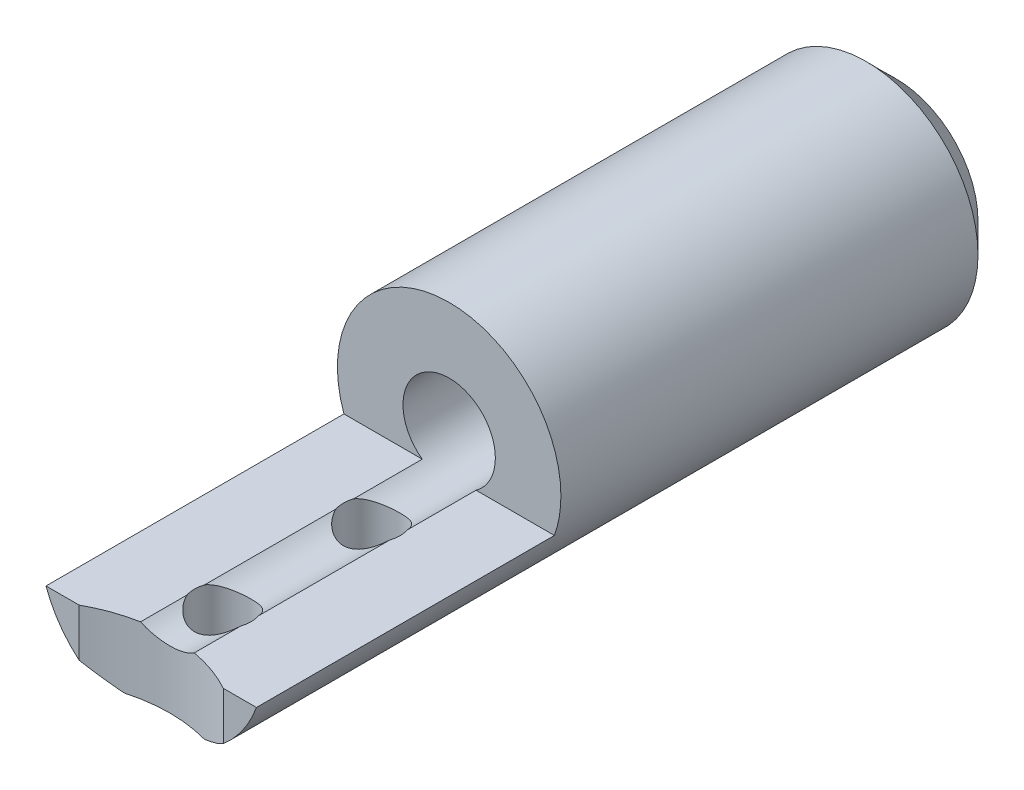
SolidWorks part; units mm, degrees
ref_plane "Front" through (0, 0, 0) normal (0, 0, 1) x (1, 0, 0)
ref_plane "Top" through (0, 0, 0) normal (0, 1, 0) x (1, 0, 0)
ref_plane "Right" through (0, 0, 0) normal (1, 0, 0) x (0, 0, -1)
sketch "Sketch1" plane through (0, 0, 0) normal (0, 0, 1) x (1, 0, 0)
  circle A0 centre (0, 0) radius 3.937
  circle A1 centre (0, 0) radius 9.525
extrude "Extrude1" add sketch "Sketch1" against normal blind 63.5
sketch "Sketch2" plane through (0, 0, 0) normal (0, 0, 1) x (1, 0, 0)
  line L0 (0, 3.2004) -> (0, -5.0881) construction
  line L1 (-9.525, -3.2004) -> (9.525, -3.2004)
  line L3 (9.525, 3.2004) -> (9.525, -3.2004)
  line L4 (-9.525, 3.2004) -> (-9.525, -3.2004)
  arc A1 (9.525, 3.2004) -> (-9.525, 3.2004) centre (0, 0.4024) ccw
  point P3 (0, -3.2004)
extrude "Cut-Extrude1" cut sketch "Sketch2" against normal blind 25.4
sketch "Sketch3" plane through (0, 0, 0) normal (0, 0, 1) x (1, 0, 0)
  line L0 (0, -3.937) -> (0, -9.525)
  line L1 (0, -9.525) -> (6.5942, -9.525)
  line L2 (6.5942, -9.525) -> (6.5942, -8.89)
  line L3 (6.5942, -8.89) -> (-6.1872, -8.89)
  line L4 (-6.1872, -8.89) -> (-6.1872, -9.525)
  line L5 (-6.1872, -9.525) -> (0, -9.525)
  arc A0 (-2.2929, -3.2004) -> (2.2929, -3.2004) centre (0, 0) ccw construction
  arc A1 (-8.9712, -3.2004) -> (8.9712, -3.2004) centre (0, 0) ccw construction
  dimension "D1" = 5.588
extrude "Cut-Extrude2" cut sketch "Sketch3" against normal up to surface (25.4 mm away) contours L1 L2 L3 L4 L5
sketch "Sketch4" plane through (0, -8.89, 0) normal (0, -1, 0) x (1, 0, 0)
  circle A0 centre (0, -6.096) radius 2.413
  circle A1 centre (0, -18.796) radius 2.413
  circle A2 centre (0, -38.9955) radius 1.8923
  circle A3 centre (0, -51.6955) radius 1.8923
extrude "Cut-Extrude3" cut sketch "Sketch4" against normal mid plane 12.7
chamfer "Chamfer2" distance 2.54 angle 45 1 edges at (9.525, 0, -63.5)
sketch "Sketch5" plane through (0, -8.89, 0) normal (0, -1, 0) x (1, 0, 0)
  circle A0 centre (0, 11.1125) radius 12.7
extrude "Cut-Extrude4" cut sketch "Sketch5" against normal through all
